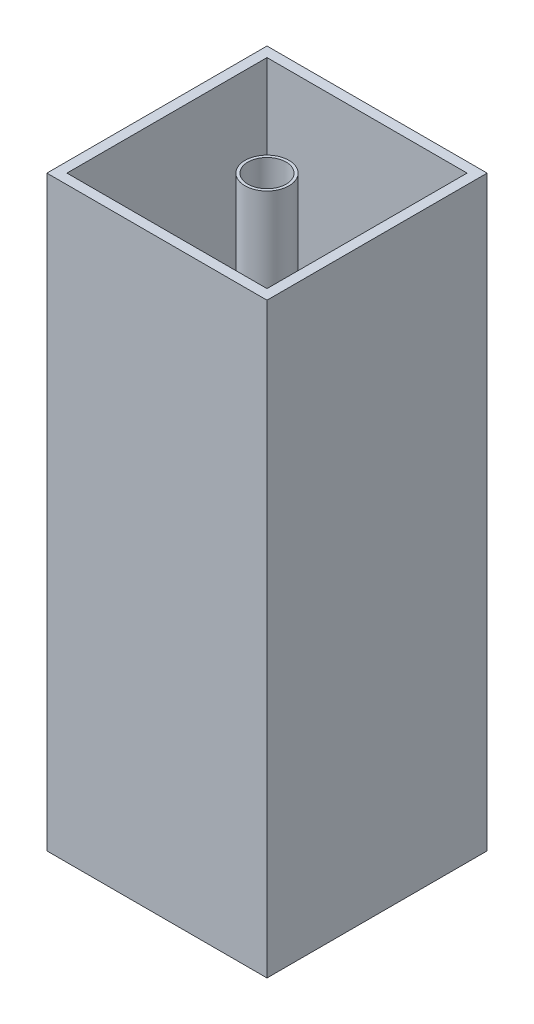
SolidWorks part; units mm, degrees
ref_plane "Front Plane" through (0, 0, 0) normal (0, 0, 1) x (1, 0, 0)
ref_plane "Top Plane" through (0, 0, 0) normal (0, 1, 0) x (1, 0, 0)
ref_plane "Right Plane" through (0, 0, 0) normal (1, 0, 0) x (0, 0, -1)
sketch "Sketch1" plane through (0, 0, 0) normal (0, 1, 0) x (1, 0, 0)
  circle A0 centre (0, 0) radius 15
  dimension "D1" = 30
extrude "Boss-Extrude1" add sketch "Sketch1" along normal blind 400
sketch "Sketch2" plane through (0, 400, 0) normal (0, 1, 0) x (1, 0, 0)
  circle A0 centre (0, 0) radius 13.0542
extrude "Cut-Extrude1" cut sketch "Sketch2" against normal blind 400
sketch "Sketch3" plane through (0, 400, 0) normal (0, 1, 0) x (1, 0, 0)
  line L1 (-75, -75) -> (75, -75)
  line L2 (-75, -75) -> (-75, 75)
  line L3 (-75, 75) -> (75, 75)
  line L4 (75, -75) -> (75, 75)
  line L5 (-75, -75) -> (75, 75) construction
  line L6 (-75, 75) -> (75, -75) construction
  line L7 (-68.1709, -68.1709) -> (68.1709, -68.1709)
  line L8 (-68.1709, -68.1709) -> (-68.1709, 68.1709)
  line L9 (-68.1709, 68.1709) -> (68.1709, 68.1709)
  line L10 (68.1709, -68.1709) -> (68.1709, 68.1709)
  line L11 (-68.1709, -68.1709) -> (68.1709, 68.1709) construction
  line L12 (-68.1709, 68.1709) -> (68.1709, -68.1709) construction
  circle A0 centre (0, 0) radius 15
  point P0 (0, 0)
  dimension "D1" = 150
  dimension "D2" = 150
extrude "Boss-Extrude2" add sketch "Sketch3" against normal blind 400 separate body contours L1 L4 L3 L2 L10 L7 L8 L9
sketch "Sketch4" plane through (0, 0, 0) normal (0, -1, 0) x (1, 0, 0)
  line L1 (-75, -75) -> (75, -75)
  line L2 (-75, -75) -> (-75, 75)
  line L3 (-75, 75) -> (75, 75)
  line L4 (75, -75) -> (75, 75)
  line L5 (-75, -75) -> (75, 75) construction
  line L6 (-75, 75) -> (75, -75) construction
  point P0 (0, 0)
extrude "Boss-Extrude3" add sketch "Sketch4" against normal blind 10
